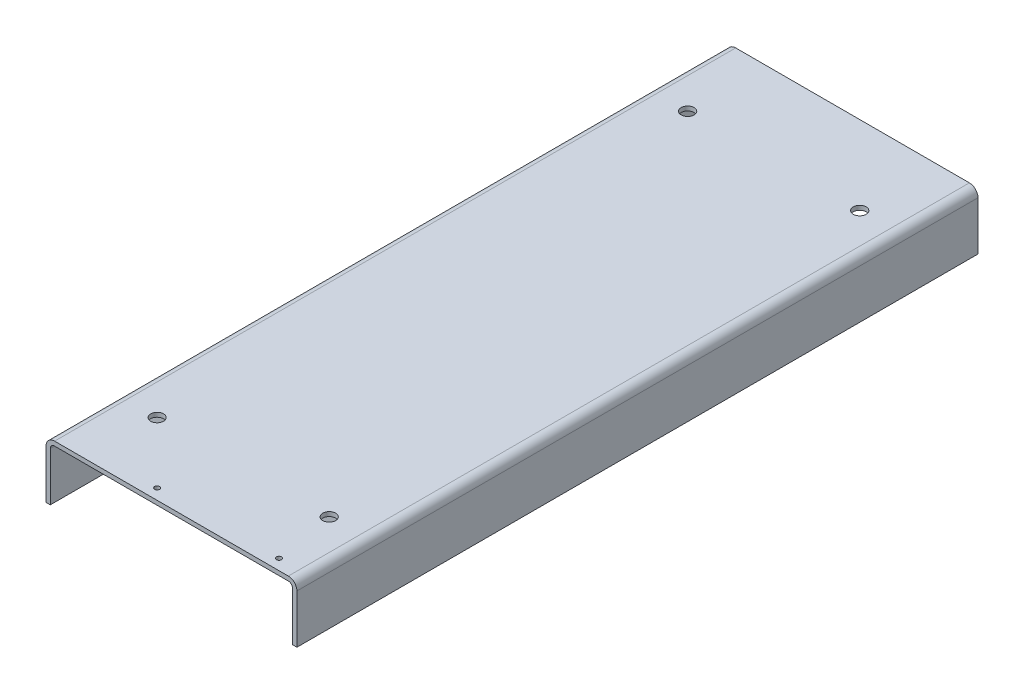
SolidWorks part; units mm, degrees
ref_plane "face" through (0, 0, 0) normal (0, 0, 1) x (1, 0, 0)
ref_plane "dessus" through (0, 0, 0) normal (0, 1, 0) x (1, 0, 0)
ref_plane "coté" through (0, 0, 0) normal (1, 0, 0) x (0, 0, -1)
sketch "Esquisse1" plane through (0, 0, 0) normal (0, 0, 1) x (1, 0, 0)
  line L0 (-175, 0) -> (-175, 80)
  line L1 (-175, 80) -> (175, 80)
  line L2 (175, 80) -> (175, 0)
  line L3 (0, 0) -> (0, 80) construction
  dimension "D1" = 350
  dimension "D2" = 80
extrude "Extru.-Mince1" add sketch "Esquisse1" against normal blind 950 thin
sketch "Esquisse2" plane through (0, 80, 0) normal (0, 1, 0) x (-1, 0, 0)
  circle A0 centre (35, -15) radius 3.5 construction
  circle A1 centre (-135, -15) radius 3.5 construction
  circle A2 centre (35, -15) radius 3.5
  circle A3 centre (-135, -15) radius 3.5
extrude "Enlèv. mat.-Extru.1" cut sketch "Esquisse2" against normal blind 6
sketch "Esquisse3" plane through (0, 74, 0) normal (0, -1, 0) x (1, 0, 0)
  line L1 (142.5056, -15) -> (138.7528, -8.5)
  line L2 (138.7528, -8.5) -> (131.2472, -8.5)
  line L3 (131.2472, -8.5) -> (127.4944, -15)
  line L4 (127.4944, -15) -> (131.2472, -21.5)
  line L5 (131.2472, -21.5) -> (138.7528, -21.5)
  line L6 (138.7528, -21.5) -> (142.5056, -15)
  line L7 (-27.4944, -15) -> (-31.2472, -8.5)
  line L8 (-31.2472, -8.5) -> (-38.7528, -8.5)
  line L9 (-38.7528, -8.5) -> (-42.5056, -15)
  line L10 (-42.5056, -15) -> (-38.7528, -21.5)
  line L11 (-38.7528, -21.5) -> (-31.2472, -21.5)
  line L12 (-31.2472, -21.5) -> (-27.4944, -15)
  circle A0 centre (135, -15) radius 6.5 construction
  circle A1 centre (-35, -15) radius 6.5 construction
  circle A2 centre (-35, -15) radius 3.5 construction
  circle A3 centre (135, -15) radius 3.5 construction
  circle A4 centre (-35, -15) radius 3.5
  circle A5 centre (135, -15) radius 3.5
  dimension "D1" = 13
extrude "Extrusion1" add sketch "Esquisse3" along normal blind 6
sketch "Esquisse4" plane through (0, 80, 0) normal (0, 1, 0) x (-1, 0, 0)
  circle A0 centre (-120, -100) radius 9 construction
  circle A1 centre (-120, -840) radius 9 construction
  circle A2 centre (120, -840) radius 9 construction
  circle A3 centre (120, -100) radius 9 construction
  circle A4 centre (-120, -100) radius 9
  circle A5 centre (-120, -840) radius 9
  circle A6 centre (120, -840) radius 9
  circle A7 centre (120, -100) radius 9
extrude "Enlèv. mat.-Extru.2" cut sketch "Esquisse4" against normal blind 6
ref_plane "Plan1" through (0, 0, -140) normal (0, 0, 1) x (1, 0, 0)
sketch "Esquisse5" plane through (0, 0, -140) normal (0, 0, 1) x (1, 0, 0)
  line L0 (-169, 0) -> (169, 0)
rib "Nervure1" sketch "Esquisse5" sketch "Esquisse5" thickness 6 extrusion direction parallel to sketch draft on no parameters "D1"=6
pattern_linear "Répétition linéaire1" count 2 spacing 670 along (0, 0, -1) of "Nervure1"
